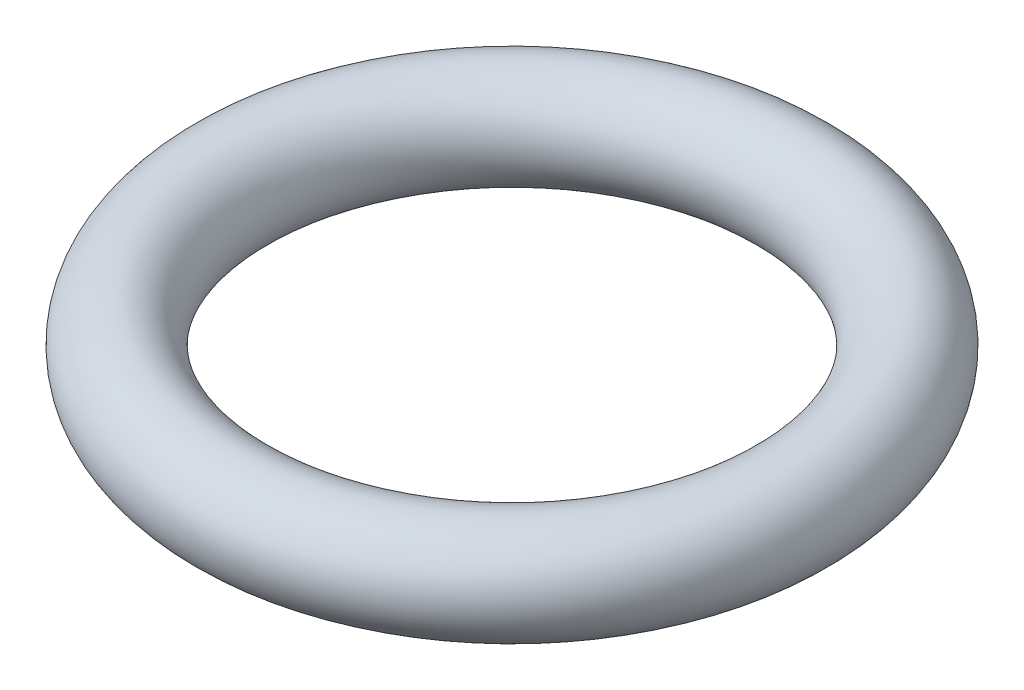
SolidWorks part; units mm, degrees
ref_plane "Face" through (0, 0, 0) normal (0, 0, 1) x (1, 0, 0)
ref_plane "Dessus" through (0, 0, 0) normal (0, 1, 0) x (1, 0, 0)
ref_plane "Droite" through (0, 0, 0) normal (1, 0, 0) x (0, 0, -1)
sketch "Esquisse1" plane through (0, 0, 0) normal (0, 0, 1) x (1, 0, 0)
  line L0 (0, 0) -> (0, 10) construction
  circle A0 centre (8.4, 0) radius 1.5
  dimension "D1" = 3
  dimension "D2" = 8.4
revolve "Base-Révolution" add sketch "Esquisse1" angle 360 about L0
sketch "Esquisse4" plane through (0, 0, 0) normal (1, 0, 0) x (0, 0, -1)
  line L0 (0, -10) -> (-20, -10)
  line L1 (0, -10) -> (0, 10)
  line L2 (-20, 10) -> (0, 10)
  line L3 (-20, 10) -> (-20, -10)
extrude "Enlèv. mat.-Extru.2" [suppressed] cut sketch "Esquisse4" against normal through all and the other way through all
